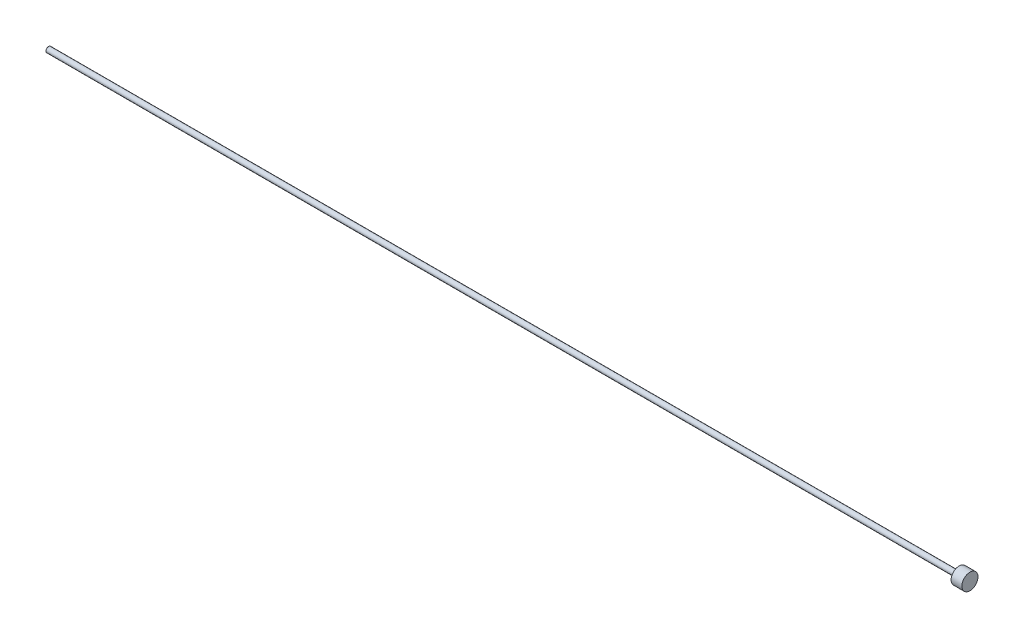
SolidWorks part; units mm, degrees
ref_plane "Front" through (0, 0, 0) normal (0, 0, 1) x (1, 0, 0)
ref_plane "Top" through (0, 0, 0) normal (0, 1, 0) x (1, 0, 0)
ref_plane "Right" through (0, 0, 0) normal (1, 0, 0) x (0, 0, -1)
sketch "Sketch2" plane through (1390.1844, 0, 0) normal (-1, 0, 0) x (0, 0, 1)
  circle A0 centre (0, 0) radius 3.175
  dimension "D1" = 6.35
extrude "Main_body" add sketch "Sketch2" along normal up to surface (1086.2945 mm away)
sketch "Sketch3" plane through (1390.1844, 0, 0) normal (-1, 0, 0) x (0, 0, 1)
  circle A0 centre (0, 0) radius 9.525
  circle A1 centre (0, 0) radius 9.525 construction
extrude "Piston Simulation" add sketch "Sketch3" along normal blind 12.7
chamfer "Chamfer1" distance 0.508 angle 45 1 edges at (303.8899, 0, 3.175)
